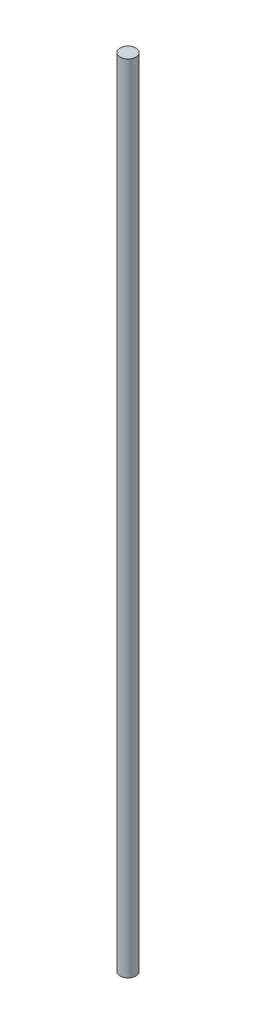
SolidWorks part; units mm, degrees
ref_plane "Front Plane" through (0, 0, 0) normal (0, 0, 1) x (1, 0, 0)
ref_plane "Top Plane" through (0, 0, 0) normal (0, 1, 0) x (1, 0, 0)
ref_plane "Right Plane" through (0, 0, 0) normal (1, 0, 0) x (0, 0, -1)
sketch "Sketch1" plane through (0, 0, 0) normal (0, 1, 0) x (1, 0, 0)
  circle A0 centre (0, 0) radius 3.175
  dimension "D1" = 6.35
extrude "Boss-Extrude1" add sketch "Sketch1" along normal blind 317.5
